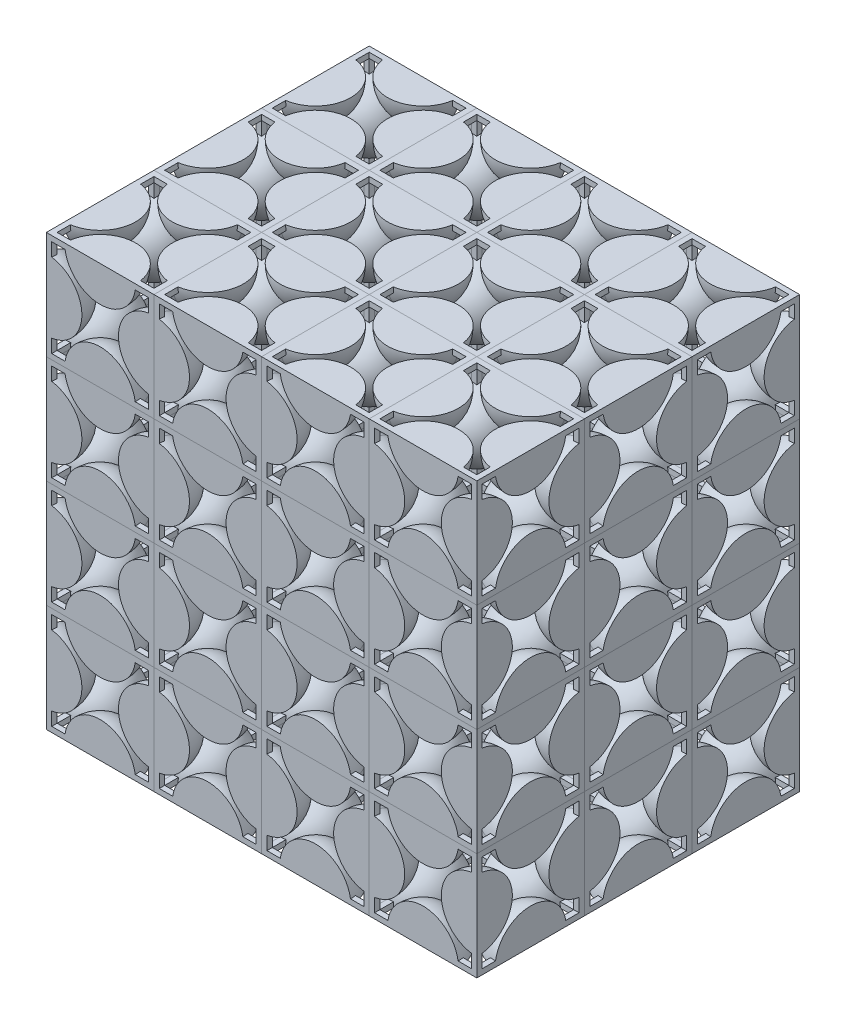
SolidWorks part; units mm, degrees
ref_plane "Front Plane" through (0, 0, 0) normal (0, 0, 1) x (1, 0, 0)
ref_plane "Top Plane" through (0, 0, 0) normal (0, 1, 0) x (1, 0, 0)
ref_plane "Right Plane" through (0, 0, 0) normal (1, 0, 0) x (0, 0, -1)
sketch "Sketch1" plane through (0, 0, 0) normal (0, 0, 1) x (1, 0, 0)
  line L1 (-7.5, 7.5) -> (7.5, 7.5)
  line L2 (-7.5, 7.5) -> (-7.5, -7.5)
  line L3 (-7.5, -7.5) -> (7.5, -7.5)
  line L4 (7.5, 7.5) -> (7.5, -7.5)
  line L5 (-7.5, 7.5) -> (7.5, -7.5) construction
  line L6 (-7.5, -7.5) -> (7.5, 7.5) construction
  point P0 (0, 0)
  dimension "D1" = 15
  dimension "D2" = 15
extrude "Boss-Extrude2" add sketch "Sketch1" along normal blind 15 contours L1 L4 L3 L2
shell "Shell4" thickness 0.75
sketch "Sketch2" plane through (0, 0, 15) normal (0, 0, 1) x (1, 0, 0)
  line L8 (-6.75, 6.75) -> (-6.75, -6.75)
  line L9 (-6.75, -6.75) -> (6.75, -6.75)
  line L10 (6.75, -6.75) -> (6.75, 6.75)
  line L11 (6.75, 6.75) -> (-6.75, 6.75)
  line L12 (-6.75, 6.75) -> (-6.75, -6.75)
  line L13 (-6.75, -6.75) -> (6.75, -6.75)
  line L14 (6.75, -6.75) -> (6.75, 6.75)
  line L15 (6.75, 6.75) -> (-6.75, 6.75)
  dimension "D1" = 0.75
extrude "Cut-Extrude1" cut sketch "Sketch2" against normal blind 15
sketch "Sketch3" plane through (0, 7.5, 0) normal (0, 1, 0) x (1, 0, 0)
  line L8 (6.75, -0.75) -> (-6.75, -0.75)
  line L9 (-6.75, -0.75) -> (-6.75, -14.25)
  line L10 (-6.75, -14.25) -> (6.75, -14.25)
  line L11 (6.75, -14.25) -> (6.75, -0.75)
  line L12 (6.75, -0.75) -> (-6.75, -0.75)
  line L13 (-6.75, -0.75) -> (-6.75, -14.25)
  line L14 (-6.75, -14.25) -> (6.75, -14.25)
  line L15 (6.75, -14.25) -> (6.75, -0.75)
  dimension "D1" = 0.75
extrude "Cut-Extrude2" cut sketch "Sketch3" against normal blind 15
sketch "Sketch6" plane through (0, 0, 15) normal (0, 0, 1) x (1, 0, 0)
  line L0 (7.5, -4.95) -> (7.5, 4.95)
  line L1 (7.5, 7.5) -> (7.5, -7.5) construction
  arc A0 (7.5, -4.95) -> (7.5, 4.95) centre (7.5, 0) cw
  point P5 (0, 0)
  dimension "D1" = 4.95
revolve "Revolve2" add sketch "Sketch6" angle 90 about L0
mirror "Mirror1" about plane through (0, 0, 0) normal (1, 0, 0) of "Revolve2"
ref_plane "Plane2" through (0, 0, 7.5) normal (0, 0, 1) x (1, 0, 0)
mirror "Mirror3" about plane through (0, 0, 7.5) normal (0, 0, 1) of "Mirror1", "Revolve2"
sketch "Sketch8" plane through (7.5, 0, 0) normal (1, 0, 0) x (0, 0, -1)
  line L0 (-15, -7.5) -> (0, -7.5) construction
  line L1 (-12.45, -7.5) -> (-2.55, -7.5)
  arc A0 (-12.45, -7.5) -> (-2.55, -7.5) centre (-7.5, -7.5) cw
revolve "Revolve3" add sketch "Sketch8" angle 90 about L1
mirror "Mirror4" about plane through (0, 0, 0) normal (1, 0, 0) of "Revolve3"
mirror "Mirror5" about plane through (0, 0, 0) normal (0, 1, 0) of "Mirror4", "Revolve3"
sketch "Sketch9" plane through (0, 0, 15) normal (0, 0, 1) x (1, 0, 0)
  line L0 (-7.5, -7.5) -> (7.5, -7.5) construction
  line L1 (4.95, -7.5) -> (-4.95, -7.5)
  arc A0 (-4.95, -7.5) -> (4.95, -7.5) centre (0, -7.5) cw
revolve "Revolve4" add sketch "Sketch9" angle 90 about L1
mirror "Mirror6" about plane through (0, 0, 0) normal (0, 1, 0) of "Revolve4"
mirror "Mirror7" about plane through (0, 0, 7.5) normal (0, 0, 1) of "Mirror6", "Revolve4"
pattern_linear "LPattern1" count 4 spacing 15 along (1, 0, 0) count 4 spacing 15 along (0, -1, 0)
pattern_linear "LPattern2" count 3 spacing 15 along (0, 0, -1)
